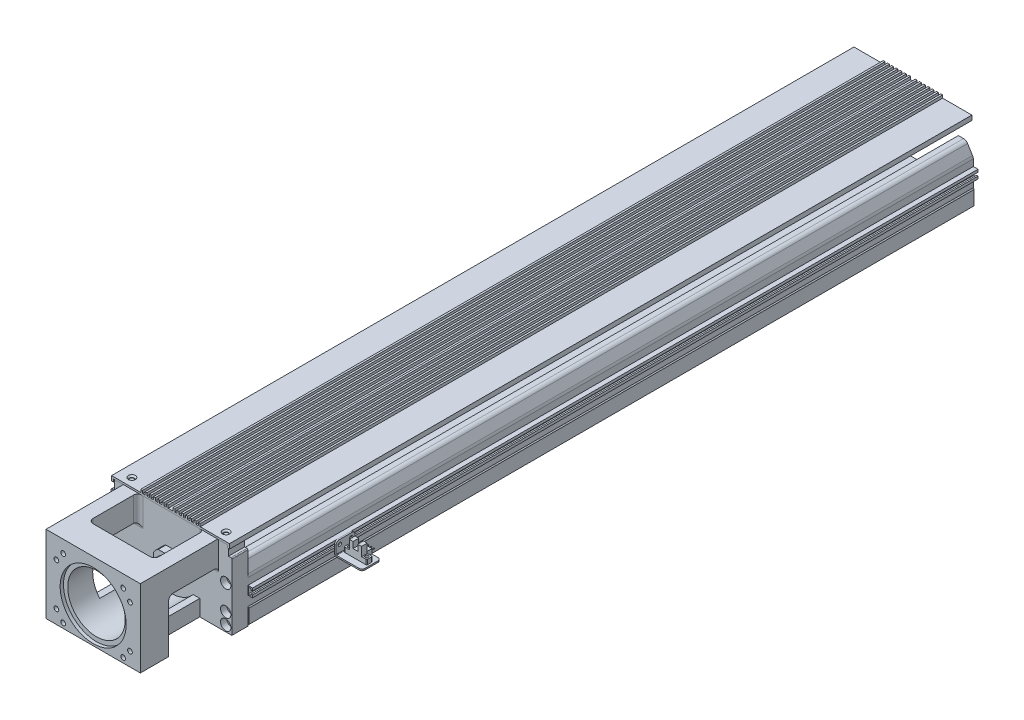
SolidWorks part; units mm, degrees
ref_plane "前视基准面" through (0, 0, 0) normal (0, 0, 1) x (1, 0, 0)
ref_plane "上视基准面" through (0, 0, 0) normal (0, 1, 0) x (1, 0, 0)
ref_plane "右视基准面" through (0, 0, 0) normal (1, 0, 0) x (0, 0, -1)
imported_body "输入1"
sketch "草图1" plane through (0, -26.631, 0) normal (0, -1, 0) x (1, 0, 0)
  line L0 (9.1742, 176.5866) -> (9.1742, 279)
  line L1 (9.1742, 192) -> (9.1742, -299) construction
  line L2 (9.1742, 299) -> (9.1742, 212) construction
  line L3 (9.1742, 279) -> (-150.3691, 279)
  line L4 (-150.3691, 279) -> (-150.3691, -447.0637)
  line L5 (-150.3691, -447.0637) -> (66.2995, -447.0637)
  line L6 (66.2995, -447.0637) -> (66.2995, 176.5866)
  line L7 (66.2995, 176.5866) -> (9.1742, 176.5866)
  line L8 (-109.8258, 399) -> (-9.8258, 399) construction
  dimension "D1" = 120
extrude "切除-拉伸1" cut sketch "草图1" against normal up to vertex
sketch "草图2" plane through (0, 0, 279) normal (0, 0, -1) x (-1, 0, 0)
  line L0 (30.3258, 61.369) -> (28.3258, 61.369) construction
  line L1 (28.3258, 61.369) -> (28.3258, 58.369) construction
  line L2 (28.3258, 58.369) -> (-2.6742, 58.369) construction
  line L3 (-2.6742, 58.369) -> (-2.6742, 53.369) construction
  line L4 (-2.6742, 53.369) -> (-0.6742, 53.369) construction
  line L5 (-0.6742, 53.369) -> (-0.6742, 56.369) construction
  line L6 (-0.6742, 56.369) -> (120.3258, 56.369) construction
  line L7 (120.3258, 56.369) -> (120.3258, 53.369) construction
  line L8 (120.3258, 53.369) -> (122.3258, 53.369) construction
  line L9 (122.3258, 53.369) -> (122.3258, 58.369) construction
  line L10 (122.3258, 58.369) -> (91.3258, 58.369) construction
  line L11 (91.3258, 58.369) -> (91.3258, 61.369) construction
  line L12 (91.3258, 61.369) -> (89.3258, 61.369) construction
  line L13 (89.3258, 61.369) -> (89.3258, 58.369) construction
  line L14 (89.3258, 58.369) -> (86.8258, 58.369) construction
  line L15 (86.8258, 58.369) -> (86.8258, 61.369) construction
  line L16 (86.8258, 61.369) -> (84.8258, 61.369) construction
  line L17 (84.8258, 61.369) -> (84.8258, 58.369) construction
  line L18 (84.8258, 58.369) -> (82.3258, 58.369) construction
  line L19 (82.3258, 58.369) -> (82.3258, 61.369) construction
  line L20 (82.3258, 61.369) -> (80.3258, 61.369) construction
  line L21 (80.3258, 61.369) -> (80.3258, 58.369) construction
  line L22 (80.3258, 58.369) -> (77.8258, 58.369) construction
  line L23 (77.8258, 58.369) -> (77.8258, 61.369) construction
  line L24 (77.8258, 61.369) -> (75.8258, 61.369) construction
  line L25 (75.8258, 61.369) -> (75.8258, 58.369) construction
  line L26 (75.8258, 58.369) -> (73.3258, 58.369) construction
  line L27 (73.3258, 58.369) -> (73.3258, 61.369) construction
  line L28 (73.3258, 61.369) -> (71.3258, 61.369) construction
  line L29 (71.3258, 61.369) -> (71.3258, 58.369) construction
  line L30 (71.3258, 58.369) -> (68.8258, 58.369) construction
  line L31 (68.8258, 58.369) -> (68.8258, 61.369) construction
  line L32 (68.8258, 61.369) -> (66.8258, 61.369) construction
  line L33 (66.8258, 61.369) -> (66.8258, 58.369) construction
  line L34 (66.8258, 58.369) -> (64.3258, 58.369) construction
  line L35 (64.3258, 58.369) -> (64.3258, 61.369) construction
  line L36 (64.3258, 61.369) -> (62.3258, 61.369) construction
  line L37 (62.3258, 61.369) -> (62.3258, 58.369) construction
  line L38 (62.3258, 58.369) -> (57.3258, 58.369) construction
  line L39 (57.3258, 58.369) -> (57.3258, 61.369) construction
  line L40 (57.3258, 61.369) -> (55.3258, 61.369) construction
  line L41 (55.3258, 61.369) -> (55.3258, 58.369) construction
  line L42 (55.3258, 58.369) -> (52.8258, 58.369) construction
  line L43 (52.8258, 58.369) -> (52.8258, 61.369) construction
  line L44 (52.8258, 61.369) -> (50.8258, 61.369) construction
  line L45 (50.8258, 61.369) -> (50.8258, 58.369) construction
  line L46 (50.8258, 58.369) -> (48.3258, 58.369) construction
  line L47 (48.3258, 58.369) -> (48.3258, 61.369) construction
  line L48 (48.3258, 61.369) -> (46.3258, 61.369) construction
  line L49 (46.3258, 61.369) -> (46.3258, 58.369) construction
  line L50 (46.3258, 58.369) -> (43.8258, 58.369) construction
  line L51 (43.8258, 58.369) -> (43.8258, 61.369) construction
  line L52 (43.8258, 61.369) -> (41.8258, 61.369) construction
  line L53 (41.8258, 61.369) -> (41.8258, 58.369) construction
  line L54 (41.8258, 58.369) -> (39.3258, 58.369) construction
  line L55 (39.3258, 58.369) -> (39.3258, 61.369) construction
  line L56 (39.3258, 61.369) -> (37.3258, 61.369) construction
  line L57 (37.3258, 61.369) -> (37.3258, 58.369) construction
  line L58 (37.3258, 58.369) -> (34.8258, 58.369) construction
  line L59 (34.8258, 58.369) -> (34.8258, 61.369) construction
  line L60 (34.8258, 61.369) -> (32.8258, 61.369) construction
  line L61 (32.8258, 61.369) -> (32.8258, 58.369) construction
  line L62 (32.8258, 58.369) -> (30.3258, 58.369) construction
  line L63 (30.3258, 58.369) -> (30.3258, 61.369) construction
  line L64 (-7.6742, 9.119) -> (-7.6742, 10.619) construction
  line L65 (-7.6742, 10.619) -> (-4.6742, 10.619) construction
  line L66 (-4.6742, 10.619) -> (-4.6742, 4.119) construction
  line L67 (-4.6742, 4.119) -> (-7.6742, 4.119) construction
  line L68 (-7.6742, 4.119) -> (-7.6742, 5.619) construction
  line L69 (-7.6742, 5.619) -> (-9.1742, 5.619) construction
  line L70 (-9.1742, 5.619) -> (-9.1742, 2.869) construction
  line L71 (-9.1742, 2.869) -> (-4.1742, 2.869) construction
  line L72 (-4.1742, 2.869) -> (-4.1742, -7.631) construction
  line L73 (-4.1742, -7.631) -> (-5.1742, -8.631) construction
  line L74 (-5.1742, -8.631) -> (-5.1742, -23.631) construction
  line L75 (-5.1742, -23.631) -> (-3.1742, -25.631) construction
  line L76 (-3.1742, -25.631) -> (3.8258, -25.631) construction
  line L77 (3.8258, -25.631) -> (4.8258, -26.631) construction
  line L78 (4.8258, -26.631) -> (39.8258, -26.631) construction
  line L79 (39.8258, -26.631) -> (40.8258, -25.631) construction
  line L80 (40.8258, -25.631) -> (78.8258, -25.631) construction
  line L81 (78.8258, -25.631) -> (79.8258, -26.631) construction
  line L82 (79.8258, -26.631) -> (114.8258, -26.631) construction
  line L83 (114.8258, -26.631) -> (115.8258, -25.631) construction
  line L84 (115.8258, -25.631) -> (122.8258, -25.631) construction
  line L85 (122.8258, -25.631) -> (124.8258, -23.631) construction
  line L86 (124.8258, -23.631) -> (124.8258, -8.631) construction
  line L87 (124.8258, -8.631) -> (123.8258, -7.631) construction
  line L88 (123.8258, -7.631) -> (123.8258, 2.869) construction
  line L89 (123.8258, 2.869) -> (128.8258, 2.869) construction
  line L90 (128.8258, 2.869) -> (128.8258, 5.619) construction
  line L91 (128.8258, 5.619) -> (127.3258, 5.619) construction
  line L92 (127.3258, 5.619) -> (127.3258, 4.119) construction
  line L93 (127.3258, 4.119) -> (124.3258, 4.119) construction
  line L94 (124.3258, 4.119) -> (124.3258, 10.619) construction
  line L95 (124.3258, 10.619) -> (127.3258, 10.619) construction
  line L96 (127.3258, 10.619) -> (127.3258, 9.119) construction
  line L97 (127.3258, 9.119) -> (128.8258, 9.119) construction
  line L98 (128.8258, 9.119) -> (128.8258, 11.869) construction
  line L99 (128.8258, 11.869) -> (123.8258, 11.869) construction
  line L100 (123.8258, 11.869) -> (123.8258, 18.935) construction
  line L101 (123.0658, 21.585) -> (117.7946, 30.019) construction
  line L102 (113.5546, 32.369) -> (107.9758, 32.369) construction
  line L103 (107.9758, 32.369) -> (107.9758, 27.4019) construction
  line L104 (107.9758, 27.4019) -> (110.4758, 24.9019) construction
  line L105 (110.4758, 24.9019) -> (111.9758, 24.9019) construction
  line L106 (111.9758, 24.9019) -> (111.9758, 14.869) construction
  line L107 (111.9758, 14.869) -> (113.8258, 14.869) construction
  line L108 (113.8258, 14.869) -> (113.8258, -0.131) construction
  line L109 (113.8258, -0.131) -> (111.9758, -0.131) construction
  line L110 (111.9758, -0.131) -> (111.9758, -11.631) construction
  line L111 (111.9758, -11.631) -> (7.6758, -11.631) construction
  line L112 (7.6758, -11.631) -> (7.6758, -0.131) construction
  line L113 (7.6758, -0.131) -> (5.8258, -0.131) construction
  line L114 (5.8258, -0.131) -> (5.8258, 14.869) construction
  line L115 (5.8258, 14.869) -> (7.6758, 14.869) construction
  line L116 (7.6758, 14.869) -> (7.6758, 24.9019) construction
  line L117 (7.6758, 24.9019) -> (9.1758, 24.9019) construction
  line L118 (9.1758, 24.9019) -> (11.6758, 27.4019) construction
  line L119 (11.6758, 27.4019) -> (11.6758, 32.369) construction
  line L120 (11.6758, 32.369) -> (6.0971, 32.369) construction
  line L121 (1.8571, 30.019) -> (-3.4141, 21.585) construction
  line L122 (-4.1742, 18.935) -> (-4.1742, 11.869) construction
  line L123 (-4.1742, 11.869) -> (-9.1742, 11.869) construction
  line L124 (-9.1742, 11.869) -> (-9.1742, 9.119) construction
  line L125 (-9.1742, 9.119) -> (-7.6742, 9.119) construction
  line L126 (30.3258, 61.369) -> (28.3258, 61.369)
  line L127 (28.3258, 61.369) -> (28.3258, 58.369)
  line L128 (28.3258, 58.369) -> (-2.6742, 58.369)
  line L129 (-2.6742, 58.369) -> (-2.6742, 53.369)
  line L130 (-2.6742, 53.369) -> (-0.6742, 53.369)
  line L131 (-0.6742, 53.369) -> (-0.6742, 56.369)
  line L132 (-0.6742, 56.369) -> (120.3258, 56.369)
  line L133 (120.3258, 56.369) -> (120.3258, 53.369)
  line L134 (120.3258, 53.369) -> (122.3258, 53.369)
  line L135 (122.3258, 53.369) -> (122.3258, 58.369)
  line L136 (122.3258, 58.369) -> (91.3258, 58.369)
  line L137 (91.3258, 58.369) -> (91.3258, 61.369)
  line L138 (91.3258, 61.369) -> (89.3258, 61.369)
  line L139 (89.3258, 61.369) -> (89.3258, 58.369)
  line L140 (89.3258, 58.369) -> (86.8258, 58.369)
  line L141 (86.8258, 58.369) -> (86.8258, 61.369)
  line L142 (86.8258, 61.369) -> (84.8258, 61.369)
  line L143 (84.8258, 61.369) -> (84.8258, 58.369)
  line L144 (84.8258, 58.369) -> (82.3258, 58.369)
  line L145 (82.3258, 58.369) -> (82.3258, 61.369)
  line L146 (82.3258, 61.369) -> (80.3258, 61.369)
  line L147 (80.3258, 61.369) -> (80.3258, 58.369)
  line L148 (80.3258, 58.369) -> (77.8258, 58.369)
  line L149 (77.8258, 58.369) -> (77.8258, 61.369)
  line L150 (77.8258, 61.369) -> (75.8258, 61.369)
  line L151 (75.8258, 61.369) -> (75.8258, 58.369)
  line L152 (75.8258, 58.369) -> (73.3258, 58.369)
  line L153 (73.3258, 58.369) -> (73.3258, 61.369)
  line L154 (73.3258, 61.369) -> (71.3258, 61.369)
  line L155 (71.3258, 61.369) -> (71.3258, 58.369)
  line L156 (71.3258, 58.369) -> (68.8258, 58.369)
  line L157 (68.8258, 58.369) -> (68.8258, 61.369)
  line L158 (68.8258, 61.369) -> (66.8258, 61.369)
  line L159 (66.8258, 61.369) -> (66.8258, 58.369)
  line L160 (66.8258, 58.369) -> (64.3258, 58.369)
  line L161 (64.3258, 58.369) -> (64.3258, 61.369)
  line L162 (64.3258, 61.369) -> (62.3258, 61.369)
  line L163 (62.3258, 61.369) -> (62.3258, 58.369)
  line L164 (62.3258, 58.369) -> (57.3258, 58.369)
  line L165 (57.3258, 58.369) -> (57.3258, 61.369)
  line L166 (57.3258, 61.369) -> (55.3258, 61.369)
  line L167 (55.3258, 61.369) -> (55.3258, 58.369)
  line L168 (55.3258, 58.369) -> (52.8258, 58.369)
  line L169 (52.8258, 58.369) -> (52.8258, 61.369)
  line L170 (52.8258, 61.369) -> (50.8258, 61.369)
  line L171 (50.8258, 61.369) -> (50.8258, 58.369)
  line L172 (50.8258, 58.369) -> (48.3258, 58.369)
  line L173 (48.3258, 58.369) -> (48.3258, 61.369)
  line L174 (48.3258, 61.369) -> (46.3258, 61.369)
  line L175 (46.3258, 61.369) -> (46.3258, 58.369)
  line L176 (46.3258, 58.369) -> (43.8258, 58.369)
  line L177 (43.8258, 58.369) -> (43.8258, 61.369)
  line L178 (43.8258, 61.369) -> (41.8258, 61.369)
  line L179 (41.8258, 61.369) -> (41.8258, 58.369)
  line L180 (41.8258, 58.369) -> (39.3258, 58.369)
  line L181 (39.3258, 58.369) -> (39.3258, 61.369)
  line L182 (39.3258, 61.369) -> (37.3258, 61.369)
  line L183 (37.3258, 61.369) -> (37.3258, 58.369)
  line L184 (37.3258, 58.369) -> (34.8258, 58.369)
  line L185 (34.8258, 58.369) -> (34.8258, 61.369)
  line L186 (34.8258, 61.369) -> (32.8258, 61.369)
  line L187 (32.8258, 61.369) -> (32.8258, 58.369)
  line L188 (32.8258, 58.369) -> (30.3258, 58.369)
  line L189 (30.3258, 58.369) -> (30.3258, 61.369)
  line L190 (-7.6742, 9.119) -> (-7.6742, 10.619)
  line L191 (-7.6742, 10.619) -> (-4.6742, 10.619)
  line L192 (-4.6742, 10.619) -> (-4.6742, 4.119)
  line L193 (-4.6742, 4.119) -> (-7.6742, 4.119)
  line L194 (-7.6742, 4.119) -> (-7.6742, 5.619)
  line L195 (-7.6742, 5.619) -> (-9.1742, 5.619)
  line L196 (-9.1742, 5.619) -> (-9.1742, 2.869)
  line L197 (-9.1742, 2.869) -> (-4.1742, 2.869)
  line L198 (-4.1742, 2.869) -> (-4.1742, -7.631)
  line L199 (-4.1742, -7.631) -> (-5.1742, -8.631)
  line L200 (-5.1742, -8.631) -> (-5.1742, -23.631)
  line L201 (-5.1742, -23.631) -> (-3.1742, -25.631)
  line L202 (-3.1742, -25.631) -> (3.8258, -25.631)
  line L203 (3.8258, -25.631) -> (4.8258, -26.631)
  line L204 (4.8258, -26.631) -> (39.8258, -26.631)
  line L205 (39.8258, -26.631) -> (40.8258, -25.631)
  line L206 (40.8258, -25.631) -> (78.8258, -25.631)
  line L207 (78.8258, -25.631) -> (79.8258, -26.631)
  line L208 (79.8258, -26.631) -> (114.8258, -26.631)
  line L209 (114.8258, -26.631) -> (115.8258, -25.631)
  line L210 (115.8258, -25.631) -> (122.8258, -25.631)
  line L211 (122.8258, -25.631) -> (124.8258, -23.631)
  line L212 (124.8258, -23.631) -> (124.8258, -8.631)
  line L213 (124.8258, -8.631) -> (123.8258, -7.631)
  line L214 (123.8258, -7.631) -> (123.8258, 2.869)
  line L215 (123.8258, 2.869) -> (128.8258, 2.869)
  line L216 (128.8258, 2.869) -> (128.8258, 5.619)
  line L217 (128.8258, 5.619) -> (127.3258, 5.619)
  line L218 (127.3258, 5.619) -> (127.3258, 4.119)
  line L219 (127.3258, 4.119) -> (124.3258, 4.119)
  line L220 (124.3258, 4.119) -> (124.3258, 10.619)
  line L221 (124.3258, 10.619) -> (127.3258, 10.619)
  line L222 (127.3258, 10.619) -> (127.3258, 9.119)
  line L223 (127.3258, 9.119) -> (128.8258, 9.119)
  line L224 (128.8258, 9.119) -> (128.8258, 11.869)
  line L225 (128.8258, 11.869) -> (123.8258, 11.869)
  line L226 (123.8258, 11.869) -> (123.8258, 18.935)
  line L227 (123.0658, 21.585) -> (117.7946, 30.019)
  line L228 (113.5546, 32.369) -> (107.9758, 32.369)
  line L229 (107.9758, 32.369) -> (107.9758, 27.4019)
  line L230 (107.9758, 27.4019) -> (110.4758, 24.9019)
  line L231 (110.4758, 24.9019) -> (111.9758, 24.9019)
  line L232 (111.9758, 24.9019) -> (111.9758, 14.869)
  line L233 (111.9758, 14.869) -> (113.8258, 14.869)
  line L234 (113.8258, 14.869) -> (113.8258, -0.131)
  line L235 (113.8258, -0.131) -> (111.9758, -0.131)
  line L236 (111.9758, -0.131) -> (111.9758, -11.631)
  line L237 (111.9758, -11.631) -> (7.6758, -11.631)
  line L238 (7.6758, -11.631) -> (7.6758, -0.131)
  line L239 (7.6758, -0.131) -> (5.8258, -0.131)
  line L240 (5.8258, -0.131) -> (5.8258, 14.869)
  line L241 (5.8258, 14.869) -> (7.6758, 14.869)
  line L242 (7.6758, 14.869) -> (7.6758, 24.9019)
  line L243 (7.6758, 24.9019) -> (9.1758, 24.9019)
  line L244 (9.1758, 24.9019) -> (11.6758, 27.4019)
  line L245 (11.6758, 27.4019) -> (11.6758, 32.369)
  line L246 (11.6758, 32.369) -> (6.0971, 32.369)
  line L247 (1.8571, 30.019) -> (-3.4141, 21.585)
  line L248 (-4.1742, 18.935) -> (-4.1742, 11.869)
  line L249 (-4.1742, 11.869) -> (-9.1742, 11.869)
  line L250 (-9.1742, 11.869) -> (-9.1742, 9.119)
  line L251 (-9.1742, 9.119) -> (-7.6742, 9.119)
  circle A0 centre (59.8258, 11.369) radius 12.5 construction
  arc A1 (123.8258, 18.935) -> (123.0658, 21.585) centre (118.8258, 18.935) ccw construction
  arc A2 (117.7946, 30.019) -> (113.5546, 32.369) centre (113.5546, 27.369) ccw construction
  arc A3 (6.0971, 32.369) -> (1.8571, 30.019) centre (6.0971, 27.369) ccw construction
  arc A4 (-3.4141, 21.585) -> (-4.1742, 18.935) centre (0.8258, 18.935) ccw construction
  circle A5 centre (59.8258, 11.369) radius 12.5
  arc A6 (123.8258, 18.935) -> (123.0658, 21.585) centre (118.8258, 18.935) ccw
  arc A7 (117.7946, 30.019) -> (113.5546, 32.369) centre (113.5546, 27.369) ccw
  arc A8 (6.0971, 32.369) -> (1.8571, 30.019) centre (6.0971, 27.369) ccw
  arc A9 (-3.4141, 21.585) -> (-4.1742, 18.935) centre (0.8258, 18.935) ccw
extrude "凸台-拉伸1" add sketch "草图2" along normal blind 749
hole_wizard "打孔尺寸(%根据)内六角圆柱头螺钉的类型1" positions "草图3" profile "草图4" counterbore size "M10" standard "GB"
sketch "草图3" plane through (0, -11.631, 0) normal (0, 1, 0) x (1, 0, 0)
  line L0 (-59.8258, -399) -> (-59.8258, -428.5856) construction
  line L1 (-9.8258, -399) -> (-109.8258, -399) construction
  line L2 (-128.8258, -299) -> (-123.8258, -299) construction
  point P0 (-94.8258, -209)
  point P8 (-24.8258, -209)
  point P45 (-94.8258, -59)
  point P46 (-24.8258, -59)
  point P47 (-94.8258, 91)
  point P48 (-24.8258, 91)
  point P49 (-94.8258, 241)
  point P50 (-24.8258, 241)
  point P51 (-94.8258, 391)
  point P52 (-24.8258, 391)
  point P53 (-94.8258, 541)
  point P54 (-24.8258, 541)
  point P55 (-94.8258, 691)
  point P56 (-24.8258, 691)
  point P57 (-94.8258, 841)
  point P58 (-24.8258, 841)
  point P59 (-94.8258, 991)
  point P60 (-24.8258, 991)
  point P61 (-94.8258, 1141)
  point P62 (-24.8258, 1141)
  point P63 (-94.8258, 1291)
  point P64 (-24.8258, 1291)
  dimension "D1" = 70
  dimension "D2" = 90
  dimension "D3" = 11
sketch "草图4" plane through (-94.8258, -11.631, 209) normal (1, 0, 0) x (0, 0, 1)
  line L0 (0, 0) -> (0, 15)
  line L1 (0, 15) -> (5.5, 15)
  line L3 (5.5, 15) -> (5.5, 10)
  line L4 (5.5, 10) -> (8.8, 10)
  line L5 (8.8, 10) -> (8.8, 0)
  line L7 (8.8, 0) -> (0, 0)
  line L11 (0, -6.35) -> (0, 107.95) construction
  dimension "通孔孔直径" = 11
  dimension "通孔孔深度" = 15
  dimension "柱形沉头孔直径" = 17.6
  dimension "柱形沉头孔深度" = 10
